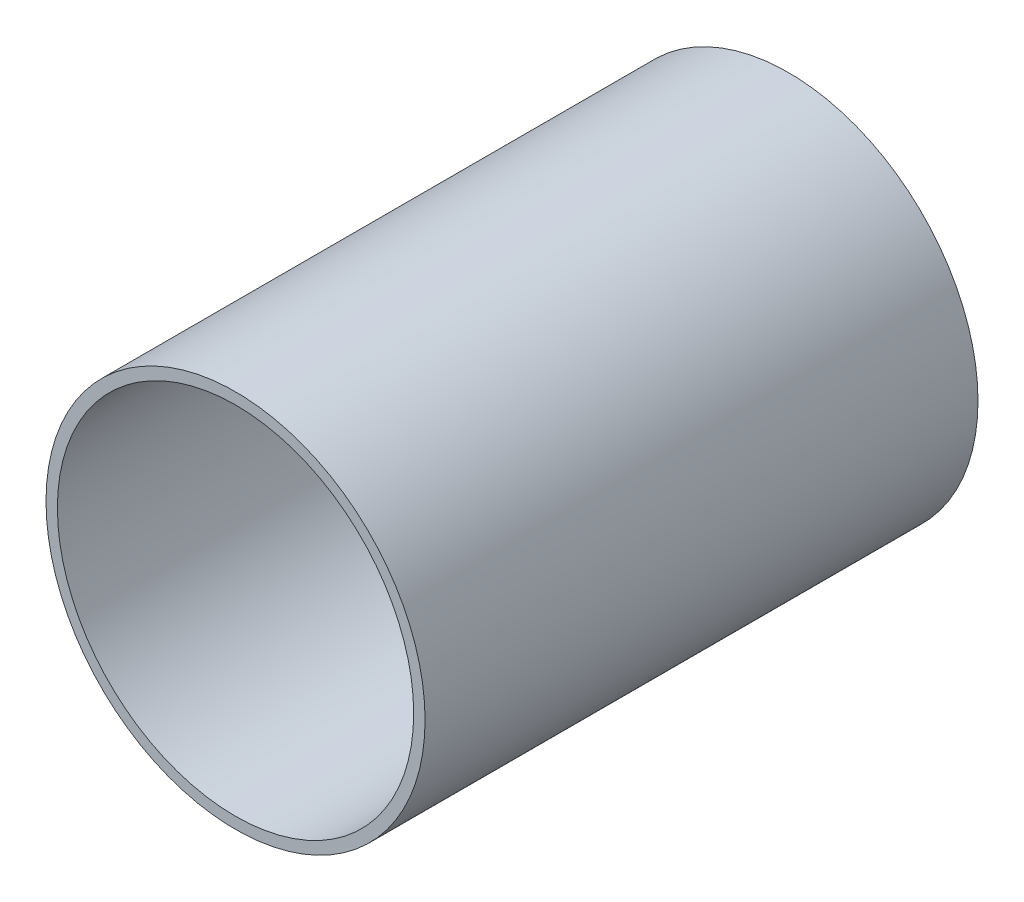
SolidWorks part; units mm, degrees
ref_plane "Face" through (0, 0, 0) normal (0, 0, 1) x (1, 0, 0)
ref_plane "Dessus" through (0, 0, 0) normal (0, 1, 0) x (1, 0, 0)
ref_plane "Droite" through (0, 0, 0) normal (1, 0, 0) x (0, 0, -1)
sketch "Esquisse1" plane through (0, 0, 0) normal (0, 0, 1) x (1, 0, 0)
  circle A0 centre (0, 0) radius 62.5
  circle A1 centre (0, 0) radius 66.5
  dimension "D1" = 125
  dimension "D2" = 133
extrude "Base-Extrusion" add sketch "Esquisse1" along normal blind 194
